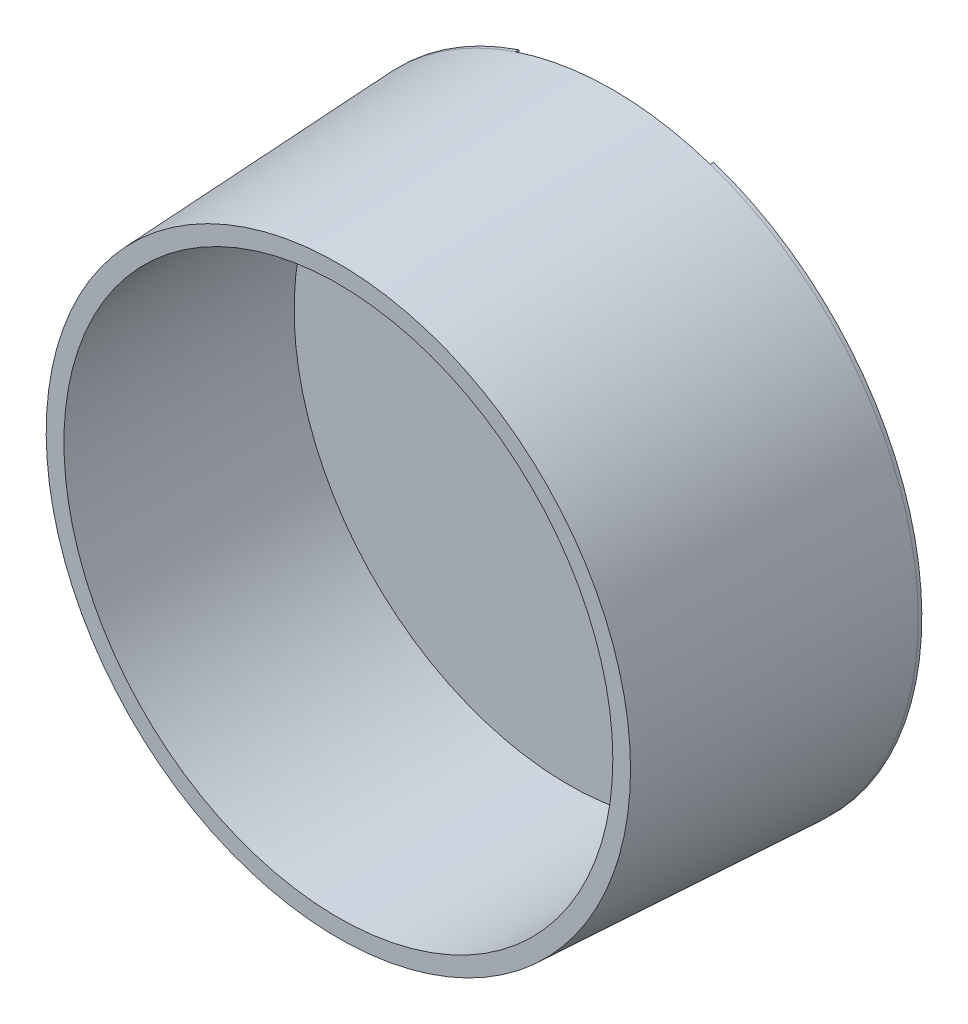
SolidWorks part; units mm, degrees
ref_plane "Plan de face" through (0, 0, 0) normal (0, 0, 1) x (1, 0, 0)
ref_plane "Plan de dessus" through (0, 0, 0) normal (0, 1, 0) x (1, 0, 0)
ref_plane "Plan de droite" through (0, 0, 0) normal (1, 0, 0) x (0, 0, -1)
ref_plane "Plan1" through (0, 0, -15.5) normal (0, 0, 1) x (1, 0, 0)
sketch "Esquisse1" plane through (0, 0, 0) normal (0, 0, 1) x (1, 0, 0)
  circle A0 centre (0, 0) radius 16.5
  dimension "D1" = 33
sketch "Esquisse2" plane through (0, 0, -15.5) normal (0, 0, 1) x (1, 0, 0)
  circle A0 centre (0, 0) radius 17.25
  dimension "D1" = 34.5
loft "Lissage1" add profiles "Esquisse1", "Esquisse2"
sketch "Esquisse3" plane through (0, 0, 0) normal (0, 0, 1) x (1, 0, 0)
  circle A0 centre (0, 0) radius 15.5
  dimension "D1" = 31
extrude "Enlèv. mat.-Extru.1" cut sketch "Esquisse3" against normal blind 13
sketch "Esquisse4" plane through (0, 0, -15.5) normal (0, 0, 1) x (1, 0, 0)
  circle A0 centre (0, 13.25) radius 0.5
  circle A1 centre (0, 0) radius 17.25 construction
  point P2 (0, 0)
  dimension "D2" = 1
  dimension "D1" = 13.25
extrude "Boss.-Extru.1" add sketch "Esquisse4" against normal blind 1
sketch "Esquisse5" plane through (0, 0, -15.5) normal (0, 0, -1) x (-1, 0, 0)
  line L0 (0, 14.25) -> (0, 18.3564) construction
  line L1 (-5.5, 16.3497) -> (-5.5, 13.1458)
  line L2 (5.5, 16.3497) -> (5.5, 13.1458)
  circle A0 centre (0, 0) radius 17.25 construction
  arc A1 (-5.5, 16.3497) -> (5.5, 16.3497) centre (0, 0) ccw
  arc A2 (-5.5, 13.1458) -> (5.5, 13.1458) centre (0, 0) ccw
  circle A4 centre (0, 0) radius 14.25 construction
  circle A5 centre (0, 0) radius 17.25 construction
  point P4 (16.4963, 5.0434)
  point P12 (-6.5172, 12.6724)
  point P13 (14.25, 0)
  dimension "D2" = 11
  dimension "D1" = 3
extrude "Boss.-Extru.2" add sketch "Esquisse5" along normal blind 0.2
sketch "Esquisse6" plane through (0, 0, -15.5) normal (0, 0, -1) x (-1, 0, 0)
  text T0 "DJI" font "Constantia" height 3.5
extrude "Boss.-Extru.3" add sketch "Esquisse6" along normal blind 0.2
